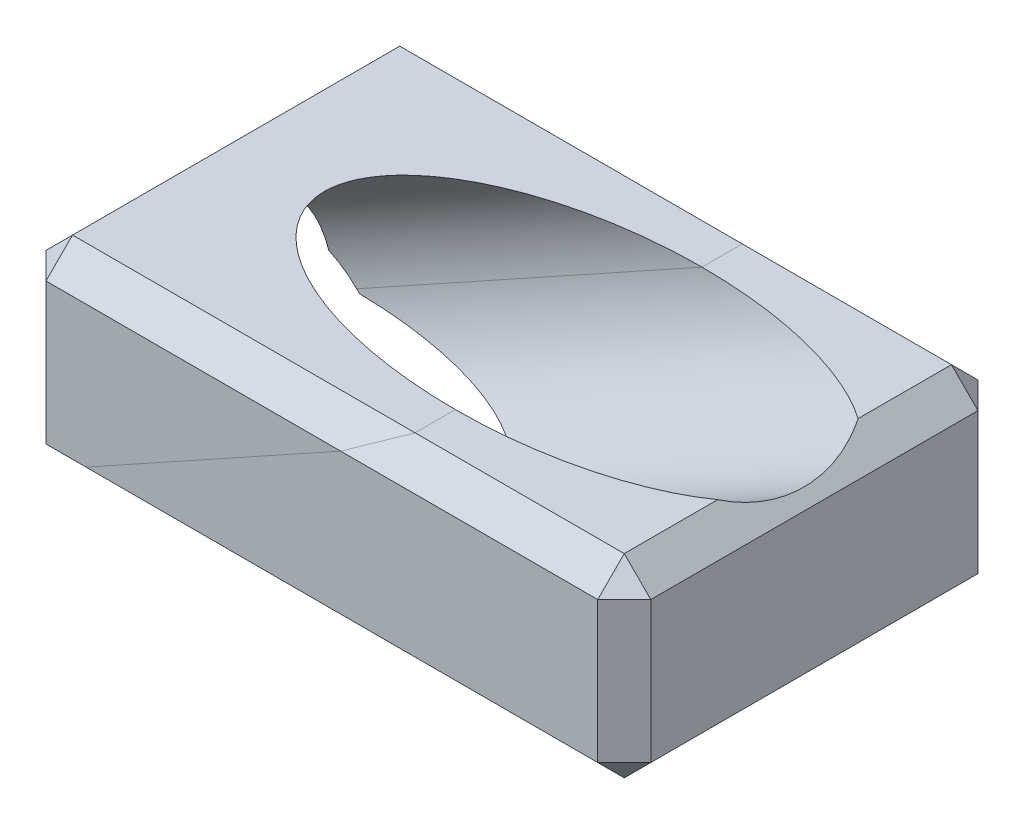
SolidWorks part; units mm, degrees
ref_plane "Front Plane" through (0, 0, 0) normal (0, 0, 1) x (1, 0, 0)
ref_plane "Top Plane" through (0, 0, 0) normal (0, 1, 0) x (1, 0, 0)
ref_plane "Right Plane" through (0, 0, 0) normal (1, 0, 0) x (0, 0, -1)
sketch "Sketch1" plane through (0, 0, 0) normal (0, 1, 0) x (1, 0, 0)
  line L1 (-114, 71.68) -> (114, 71.68)
  line L2 (-114, 71.68) -> (-114, -71.68)
  line L3 (-114, -71.68) -> (114, -71.68)
  line L4 (114, 71.68) -> (114, -71.68)
  line L5 (-114, 71.68) -> (114, -71.68) construction
  line L6 (-114, -71.68) -> (114, 71.68) construction
  point P0 (0, 0)
  dimension "D1" = 228
  dimension "D2" = 143.36
extrude "Boss-Extrude1" add sketch "Sketch1" along normal blind 73.22 contours L4 L3 L2 L1
chamfer "Chamfer1" distance 10 angle 45 12 edges at (0, 73.22, 71.68) (0, 73.22, -71.68) (114, 36.61, 71.68) (114, 73.22, 0) (114, 36.61, -71.68) (0, 0, 71.68) (114, 0, 0) (0, 0, -71.68) (-114, 36.61, -71.68) (-114, 73.22, 0) (-114, 36.61, 71.68) (-114, 0, 0)
other "Cavity1"
other "Arm slot clutter<1>@Assem1"
ref_plane "Plane1" through (-25.1385, 45.351, 0) normal (-0.4848, 0.8746, 0) x (0.8746, 0.4848, 0)
split "Split1" trim tools "Plane1" bodies to split 103 resulting bodies 104 105
